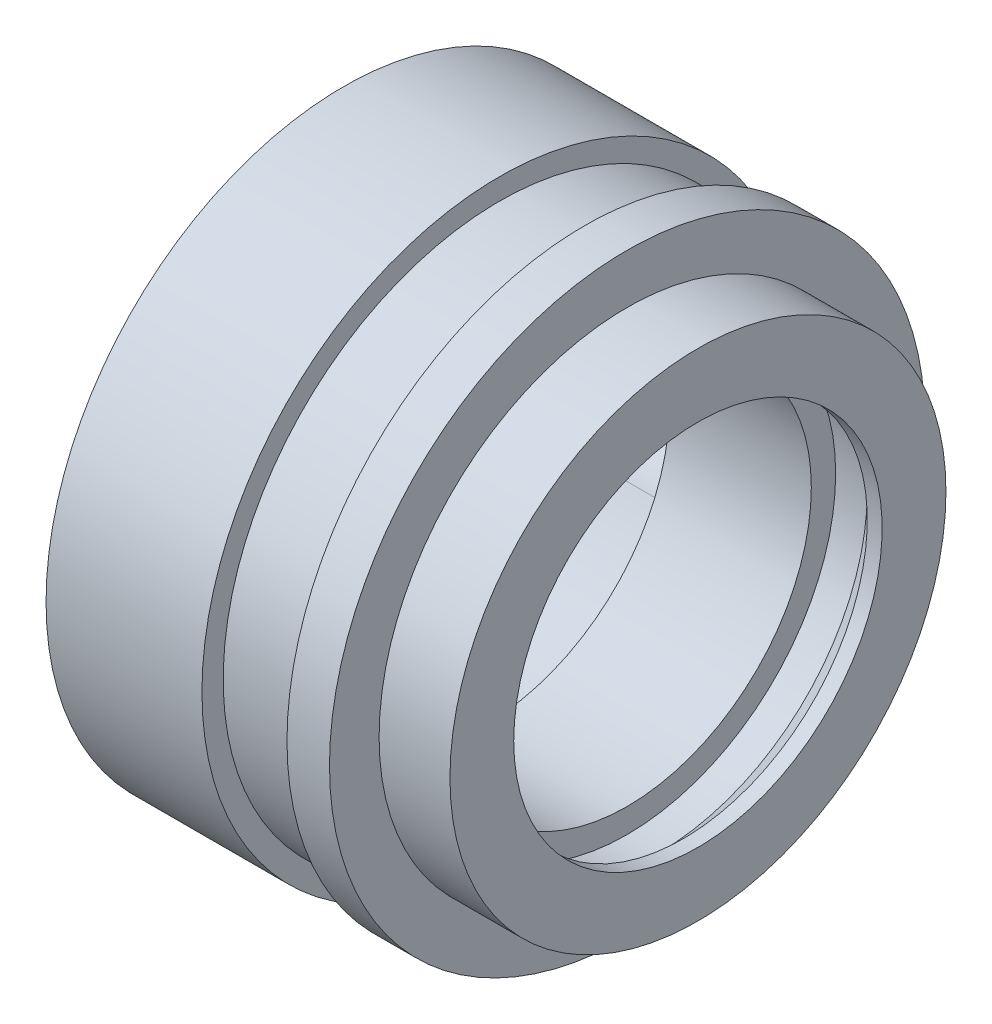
SolidWorks part; units mm, degrees
ref_plane "Face" through (0, 0, 0) normal (0, 0, 1) x (1, 0, 0)
ref_plane "Dessus" through (0, 0, 0) normal (0, 1, 0) x (1, 0, 0)
ref_plane "Droite" through (0, 0, 0) normal (1, 0, 0) x (0, 0, -1)
sketch "Esquisse1" plane through (0, 0, 0) normal (0, 0, 1) x (1, 0, 0)
  line L0 (35.4426, 0) -> (-38.695, 0) construction
  line L1 (11.5, 0) -> (11.5, 17.5)
  line L2 (6.5, 21) -> (3.5, 21)
  line L3 (3.5, 21) -> (3.5, 19.5)
  line L4 (3.5, 19.5) -> (-2.5, 19.5)
  line L5 (-2.5, 19.5) -> (-2.5, 21)
  line L6 (-2.5, 21) -> (-13.5, 21)
  line L7 (-13.5, 21) -> (-13.5, 0)
  line L8 (11.5, 0) -> (-13.5, 0)
  line L9 (6.5, 21) -> (6.5, 17.5)
  line L10 (6.5, 17.5) -> (11.5, 17.5)
  dimension "D1" = 42
  dimension "D2" = 3
  dimension "D3" = 11
  dimension "D4" = 25
  dimension "D5" = 6
  dimension "D6" = 1.5
  dimension "D7" = 11.5
  dimension "D8" = 35
revolve "Base-Révolution" add sketch "Esquisse1" angle 360 about L0
sketch "Esquisse2" plane through (11.5, 0, 0) normal (1, 0, 0) x (0, 0, -1)
  circle A0 centre (0, 0) radius 7.25
  dimension "D1" = 14.5
extrude "Enlèv. mat.-Extru.1" cut sketch "Esquisse2" against normal through all
sketch "Esquisse3" plane through (-13.5, 0, 0) normal (-1, 0, 0) x (0, 0, 1)
  circle A0 centre (0, 0) radius 7.75
  dimension "D1" = 15.5
extrude "Enlèv. mat.-Extru.2" cut sketch "Esquisse3" against normal blind 6
sketch "Esquisse4" plane through (0, 0, 0) normal (0, 0, 1) x (1, 0, 0)
  line L0 (0, 0) -> (24.8309, 0) construction
  line L1 (-13.5, 21) -> (-13.5, -21) construction
  line L2 (-13.5, 15) -> (-13.5, 0)
  line L3 (-13.5, 15) -> (-3.5, 15)
  line L4 (-3.5, 15) -> (-3.5, 13)
  line L5 (-3.5, 13) -> (11.5, 13)
  line L6 (11.5, -17.5) -> (11.5, 17.5) construction
  line L7 (11.5, 13) -> (11.5, 0)
  line L8 (11.5, 0) -> (-13.5, 0)
  dimension "D1" = 10
  dimension "D2" = 30
  dimension "D3" = 26
revolve "Enlèvement de matière-Révolution4" cut sketch "Esquisse4" angle 360 about L0
other "Empreinte1"
other "Embout_guidon_R1-5<1>@creation empreintes"
sketch "Esquisse5" plane through (-13.5, 0, 0) normal (-1, 0, 0) x (0, 0, 1)
  line L0 (0, 0) -> (0, 22.0182) construction
  arc A0 (-14.2306, 4.7424) -> (-14.2306, -4.7424) centre (-14.5, 0) ccw
  circle A2 centre (0, 0) radius 15 construction
  arc A3 (-14.2306, 4.7424) -> (-14.2306, -4.7424) centre (0, 0) ccw
  dimension "D1" = 9.5
  dimension "D2" = 14.5
extrude "Enlèv. mat.-Extru.3" cut sketch "Esquisse5" against normal up to surface (10 mm away)
mirror "Symétrie1" about plane through (0, 0, 0) normal (0, 0, 1) of "Enlèv. mat.-Extru.3"
fillet "Congé1" radius 4 4 edges at (-8.5, -4.7424, 14.2306) (-8.5, 4.7424, 14.2306) (-8.5, 4.7424, -14.2306) (-8.5, -4.7424, -14.2306)
